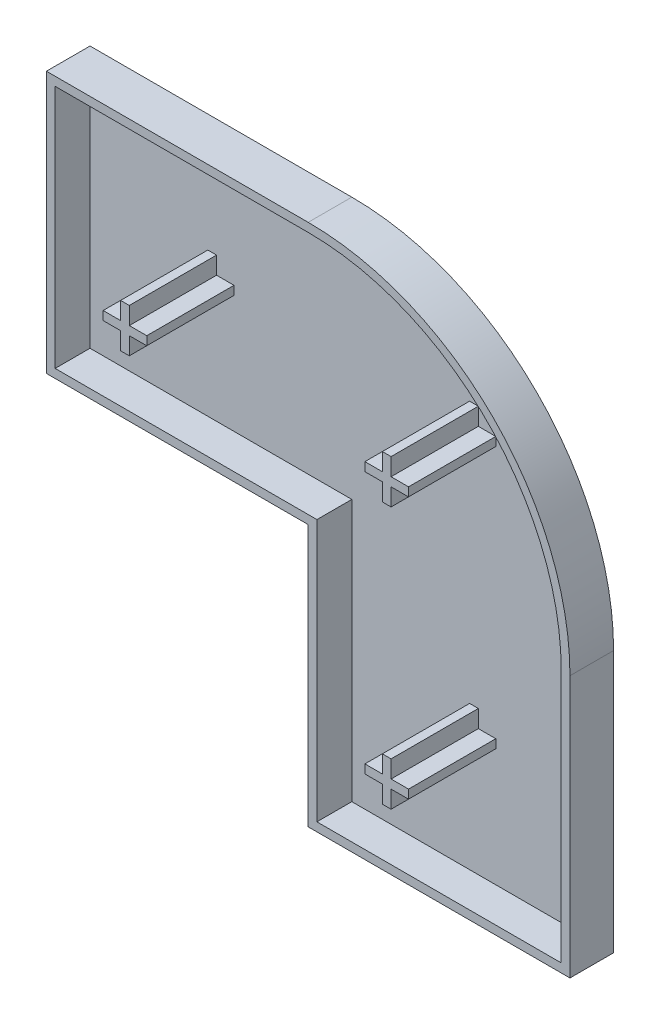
SolidWorks part; units mm, degrees
ref_plane "前视基准面" through (0, 0, 0) normal (0, 0, 1) x (1, 0, 0)
ref_plane "上视基准面" through (0, 0, 0) normal (0, 1, 0) x (1, 0, 0)
ref_plane "右视基准面" through (0, 0, 0) normal (1, 0, 0) x (0, 0, -1)
sketch "草图1" plane through (0, 0, 0) normal (0, 0, 1) x (1, 0, 0)
  line L1 (-30, 30) -> (0, 30)
  line L2 (-30, 30) -> (-30, 0)
  line L3 (0, -30) -> (30, -30)
  line L4 (30, 0) -> (30, -30)
  line L5 (0, 0) -> (-30, 0)
  line L6 (0, 0) -> (0, -30)
  arc A0 (30, 0) -> (0, 30) centre (0, 0) ccw
  dimension "D3" = 30
extrude "凸台-拉伸1" add sketch "草图1" along normal mid plane 5
shell "抽壳1" thickness 1
sketch "草图2" plane through (0, 0, -1.5) normal (0, 0, 1) x (1, 0, 0)
  line L0 (15.5, 15.5) -> (17.5, 15.5)
  line L1 (12.5, 15.5) -> (14.5, 15.5)
  line L2 (12.5, 15.5) -> (12.5, 14.5)
  line L3 (12.5, 14.5) -> (14.5, 14.5)
  line L4 (17.5, 15.5) -> (17.5, 14.5)
  line L5 (14.5, 17.5) -> (15.5, 17.5)
  line L6 (14.5, 17.5) -> (14.5, 15.5)
  line L7 (14.5, 12.5) -> (15.5, 12.5)
  line L8 (15.5, 17.5) -> (15.5, 15.5)
  line L9 (14.5, 14.5) -> (14.5, 12.5)
  line L10 (15.5, 14.5) -> (15.5, 12.5)
  line L11 (15.5, 14.5) -> (17.5, 14.5)
  line L12 (15, 17.5) -> (15, 12.5) construction
  line L13 (15, 12.5) -> (12.5, 15) construction
  line L14 (12.5, 15) -> (17.5, 15) construction
  line L15 (0, 30) -> (-30, 30) construction
  line L17 (-30, 30) -> (-30, 0) construction
  line L18 (-15, 22.5716) -> (-15, 7.6564) construction
  line L19 (-23.7017, 15) -> (-6.8274, 15) construction
  line L21 (-12.5, 15.5) -> (-12.5, 14.5)
  line L23 (-14.5, 17.5) -> (-14.5, 15.5)
  line L24 (-15.5, 14.5) -> (-15.5, 12.5)
  line L25 (-14.5, 14.5) -> (-14.5, 12.5)
  line L26 (-15, 17.5) -> (-15, 12.5) construction
  line L27 (-17.5, 15) -> (-12.5, 15) construction
  line L28 (-14.5, 15.5) -> (-12.5, 15.5)
  line L29 (-17.5, 15.5) -> (-15.5, 15.5)
  line L30 (-17.5, 15.5) -> (-17.5, 14.5)
  line L31 (-17.5, 14.5) -> (-15.5, 14.5)
  line L32 (-15.5, 17.5) -> (-14.5, 17.5)
  line L33 (-15.5, 17.5) -> (-15.5, 15.5)
  line L34 (-15.5, 12.5) -> (-14.5, 12.5)
  line L35 (-14.5, 14.5) -> (-12.5, 14.5)
  line L36 (-15, 12.5) -> (-17.5, 15) construction
  line L37 (0, 0) -> (21.2132, 21.2132) construction
  line L38 (12.5, -15) -> (15, -17.5) construction
  line L39 (15, -17.5) -> (15, -12.5) construction
  line L40 (17.5, -15) -> (12.5, -15) construction
  line L41 (14.5, -14.5) -> (14.5, -12.5)
  line L42 (12.5, -15.5) -> (12.5, -14.5)
  line L43 (17.5, -15.5) -> (15.5, -15.5)
  line L44 (17.5, -15.5) -> (17.5, -14.5)
  line L45 (14.5, -17.5) -> (14.5, -15.5)
  line L46 (15.5, -17.5) -> (14.5, -17.5)
  line L47 (15.5, -17.5) -> (15.5, -15.5)
  line L49 (15.5, -14.5) -> (15.5, -12.5)
  line L50 (14.5, -14.5) -> (12.5, -14.5)
  line L51 (14.5, -15.5) -> (12.5, -15.5)
  line L52 (17.5, -14.5) -> (15.5, -14.5)
  line L53 (15.5, -12.5) -> (14.5, -12.5)
  arc A0 (30, 0) -> (0, 30) centre (0, 0) ccw construction
  dimension "D1" = 1
  dimension "D2" = 1
  dimension "D3" = 5
  dimension "D4" = 5
  dimension "D5" = 2
  dimension "D6" = 2
  dimension "D7" = 15
  dimension "D8" = 45
  dimension "D9" = 15
extrude "凸台-拉伸2" add sketch "草图2" along normal blind 10
